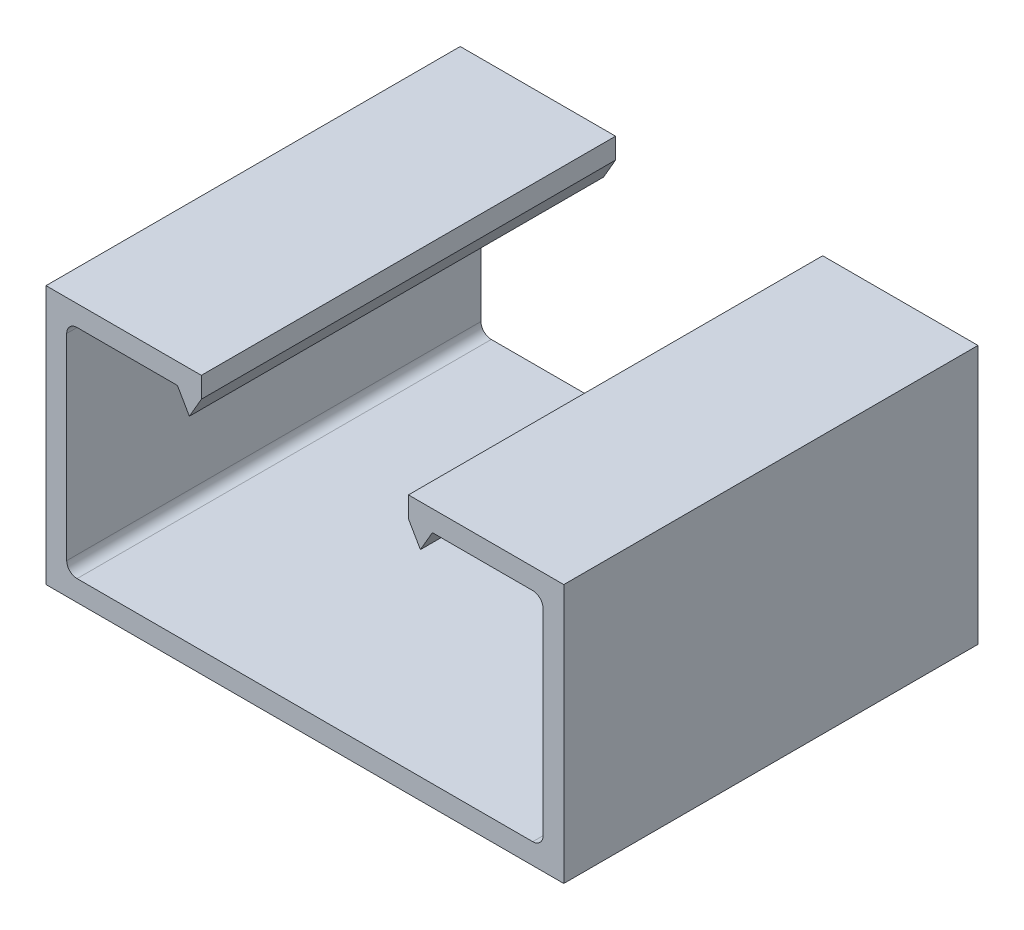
SolidWorks part; units mm, degrees
ref_plane "Plane1" through (0, 0, 0) normal (0, 0, 1) x (1, 0, 0)
ref_plane "Plane2" through (0, 0, 0) normal (0, 1, 0) x (1, 0, 0)
ref_plane "Plane3" through (0, 0, 0) normal (1, 0, 0) x (0, 0, -1)
sketch "Sketch1" plane through (0, 0, 0) normal (0, 0, 1) x (1, 0, 0)
  line L0 (-6.35, 7.9375) -> (-15.875, 7.9375)
  line L1 (-15.875, 7.9375) -> (-15.875, -7.9375)
  line L2 (-15.875, -7.9375) -> (15.875, -7.9375)
  line L3 (15.875, -7.9375) -> (15.875, 7.9375)
  line L4 (15.875, 7.9375) -> (6.35, 7.9375)
  line L5 (13.97, 6.6675) -> (7.8165, 6.6675)
  line L6 (14.605, -6.0325) -> (14.605, 6.0325)
  line L7 (-13.97, -6.6675) -> (13.97, -6.6675)
  line L8 (-14.605, 6.0325) -> (-14.605, -6.0325)
  line L9 (-7.8165, 6.6675) -> (-13.97, 6.6675)
  line L10 (7.8165, 6.6675) -> (7.0832, 5.3975)
  line L11 (7.0832, 5.3975) -> (6.35, 6.6675)
  line L12 (6.35, 6.6675) -> (6.35, 7.9375)
  line L13 (-7.8165, 6.6675) -> (-7.0832, 5.3975)
  line L14 (-7.0832, 5.3975) -> (-6.35, 6.6675)
  line L15 (-6.35, 6.6675) -> (-6.35, 7.9375)
  arc A0 (-14.605, -6.0325) -> (-13.97, -6.6675) centre (-13.97, -6.0325) ccw
  arc A1 (-13.97, 6.6675) -> (-14.605, 6.0325) centre (-13.97, 6.0325) ccw
  arc A2 (14.605, 6.0325) -> (13.97, 6.6675) centre (13.97, 6.0325) ccw
  arc A3 (13.97, -6.6675) -> (14.605, -6.0325) centre (13.97, -6.0325) ccw
  dimension "D5" = 0.635
  dimension "D4" = 60
  dimension "Width" = 31.75
  dimension "Height" = 15.875
  dimension "D8" = 15.875
  dimension "D9" = 7.9375
  dimension "D10" = 12.7
  dimension "edge" = 9.525
  dimension "D13" = 0.7332
extrude "Base-Extrude" add sketch "Sketch1" along normal mid plane 25.4
equation "\"D8@Sketch1\" = \"Width@Sketch1\" / 2"
equation "\"D9@Sketch1\" = \"Height@Sketch1\" / 2"
equation "\"D10@Sketch1\" = \"Width@Sketch1\" - 2 * \"edge@Sketch1\""
equation "\"D5@Sketch1\" = \"gauge@Sketch1\" / 2"
equation "\"D13@Sketch1\" = \"gauge@Sketch1\" * .577350269"
